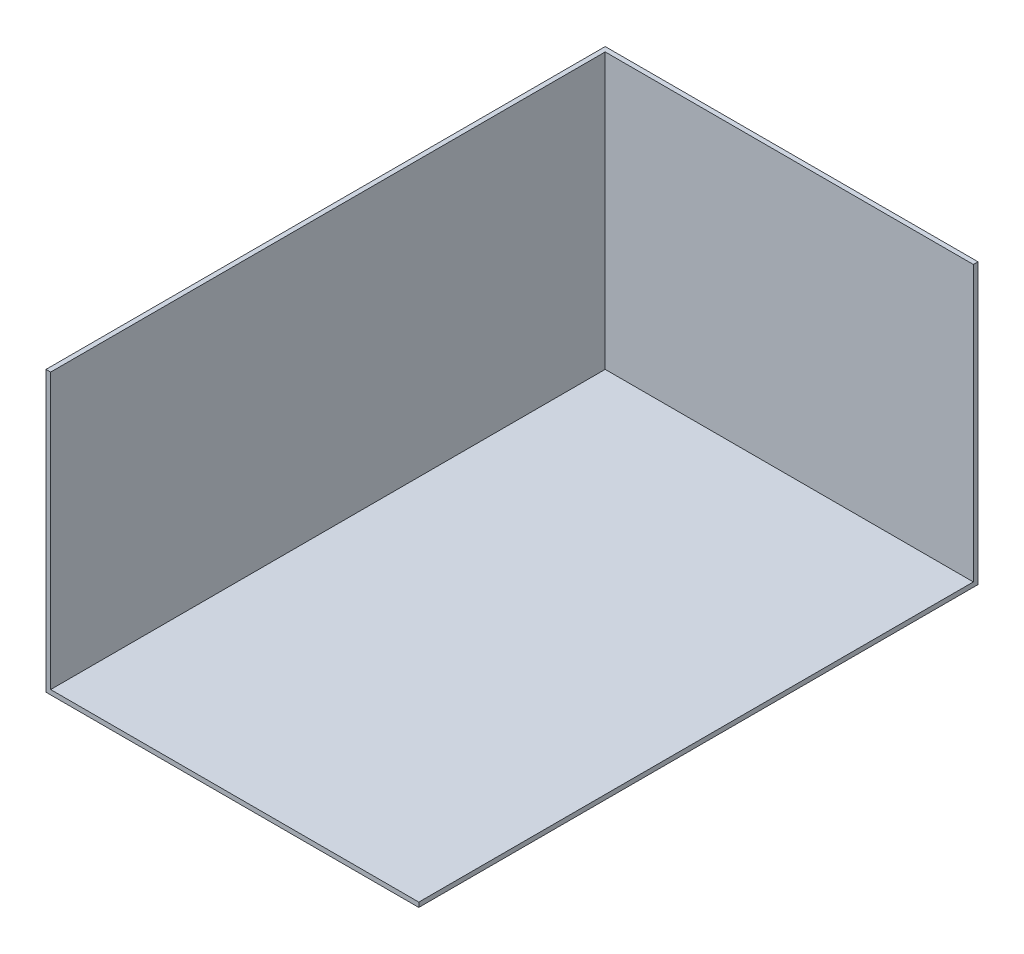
SolidWorks part; units mm, degrees
ref_plane "Front Plane" through (0, 0, 0) normal (0, 0, 1) x (1, 0, 0)
ref_plane "Top Plane" through (0, 0, 0) normal (0, 1, 0) x (1, 0, 0)
ref_plane "Right Plane" through (0, 0, 0) normal (1, 0, 0) x (0, 0, -1)
sketch "Sketch1" plane through (0, 0, 0) normal (0, 1, 0) x (1, 0, 0)
  line L1 (254, -381) -> (-254, -381)
  line L2 (254, -381) -> (254, 381)
  line L3 (254, 381) -> (-254, 381)
  line L4 (-254, -381) -> (-254, 381)
  line L5 (254, -381) -> (-254, 381) construction
  line L6 (254, 381) -> (-254, -381) construction
  point P0 (0, 0)
  dimension "D1" = 762
  dimension "D2" = 508
extrude "Boss-Extrude1" add sketch "Sketch1" along normal blind 381
shell "Shell1" thickness 6.35
